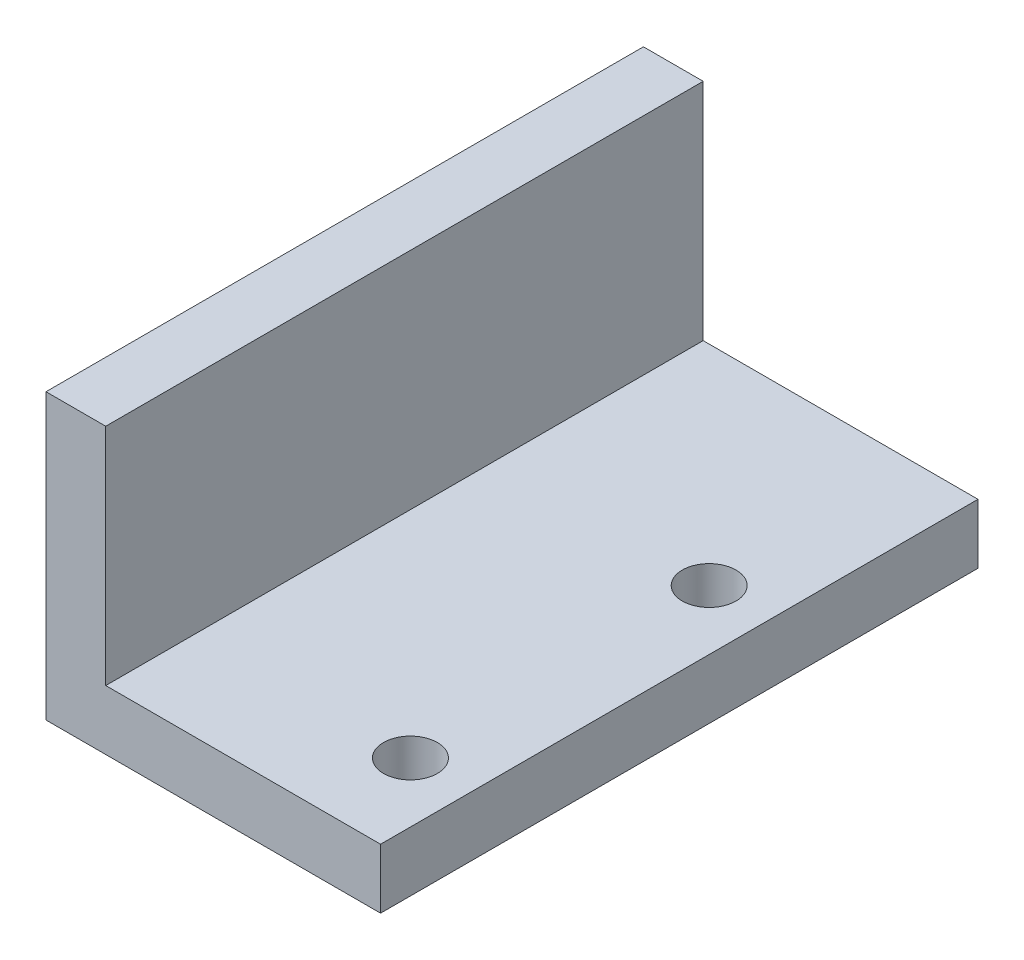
SolidWorks part; units mm, degrees
ref_plane "Face" through (0, 0, 0) normal (0, 0, 1) x (1, 0, 0)
ref_plane "Dessus" through (0, 0, 0) normal (0, 1, 0) x (1, 0, 0)
ref_plane "Droite" through (0, 0, 0) normal (1, 0, 0) x (0, 0, -1)
sketch "Esquisse1" plane through (0, 0, 0) normal (0, 0, 1) x (1, 0, 0)
  line L0 (0, 0) -> (0, 95.1854)
  line L1 (0, 95.1854) -> (20, 95.1854)
  line L2 (20, 95.1854) -> (20, 20)
  line L3 (20, 20) -> (112, 20)
  line L4 (112, 20) -> (112, 0)
  line L5 (112, 0) -> (0, 0)
  dimension "D1" = 112
  dimension "D2" = 20
  dimension "D3" = 20
extrude "Boss.-Extru.1" add sketch "Esquisse1" along normal mid plane 200
hole_wizard "Diamètre du perçage Ø18.0 (18)1" positions "Esquisse2" profile "Esquisse3" hole size "Ø18.0" standard "ISO"
sketch "Esquisse2" plane through (0, 20, 0) normal (0, 1, 0) x (1, 0, 0)
  line L1 (112, -100) -> (112, 100) construction
  line L4 (112, 100) -> (20, 100) construction
  point P0 (92, -30)
  point P2 (92, 70)
  dimension "D1" = 100
  dimension "D2" = 30
  dimension "D3" = 20
sketch "Esquisse3" plane through (92, 20, 30) normal (1, 0, 0) x (0, 0, 1)
  line L0 (0, 0) -> (0, 30.2877)
  line L1 (0, 30.2877) -> (9, 24.88)
  line L2 (9, 24.88) -> (9, 0)
  line L5 (9, 0) -> (0, 0)
  line L10 (0, 30.2877) -> (-9, 24.88) construction
  line L11 (0, -6.35) -> (0, 107.95) construction
  dimension "Diamètre du perçage" = 18
  dimension "Profondeur du perçage" = 24.88
  dimension "Angle de pointe" = 118
move or copy body "Corps-Déplacer/Copier1" bodies to move or copy 102
